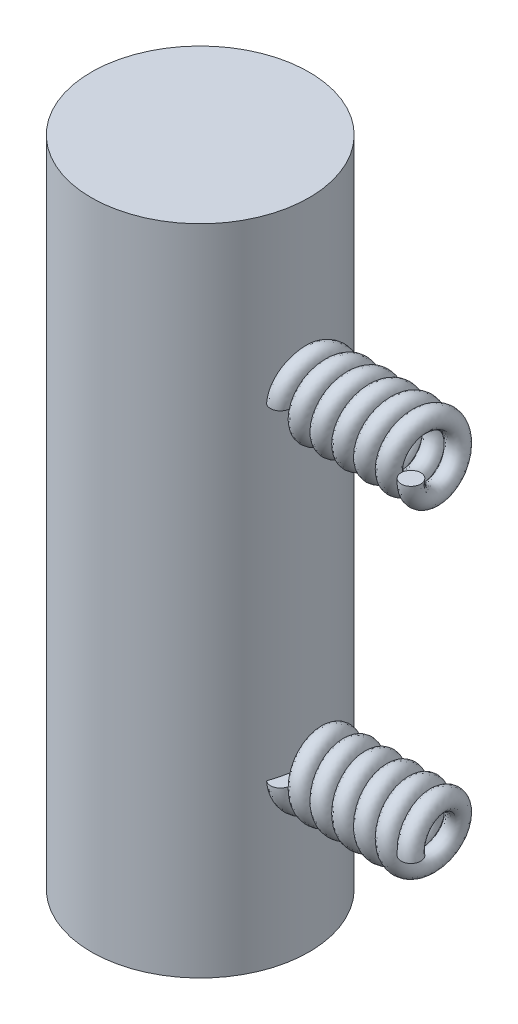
SolidWorks part; units mm, degrees
ref_plane "Front Plane" through (0, 0, 0) normal (0, 0, 1) x (1, 0, 0)
ref_plane "Top Plane" through (0, 0, 0) normal (0, 1, 0) x (1, 0, 0)
ref_plane "Right Plane" through (0, 0, 0) normal (1, 0, 0) x (0, 0, -1)
sketch "Sketch1" plane through (0, 0, 0) normal (0, 1, 0) x (1, 0, 0)
  circle A0 centre (0, 0) radius 5
  dimension "D1" = 10
extrude "Boss-Extrude1" add sketch "Sketch1" along normal mid plane 30
ref_plane "Plane1" through (5, 0, 0) normal (1, 0, 0) x (0, 0, -1)
sketch "Sketch3" plane through (5, 0, 0) normal (1, 0, 0) x (0, 0, -1)
  circle A0 centre (0, 7.5) radius 1.3213
  dimension "D1" = 7.5
curve "Helix/Spiral1"
ref_plane "Plane2" through (0, 7.5, 0) normal (0, 1, 0) x (1, 0, 0)
sketch "Sketch4" plane through (0, 7.5, 0) normal (0, 1, 0) x (1, 0, 0)
  line L0 (5, -5.5) -> (5, 5.5) construction
  circle A0 centre (5, -1.3213) radius 0.45
  spline S0 degree 3 number of poles 89 (5, -1.3213) -> (11, -1.3213) construction
sweep "Sweep1" add profiles "Sketch4" path "Helix/Spiral1"
mirror "Mirror1" about plane through (0, 0, 0) normal (0, 1, 0) of "Sweep1"
